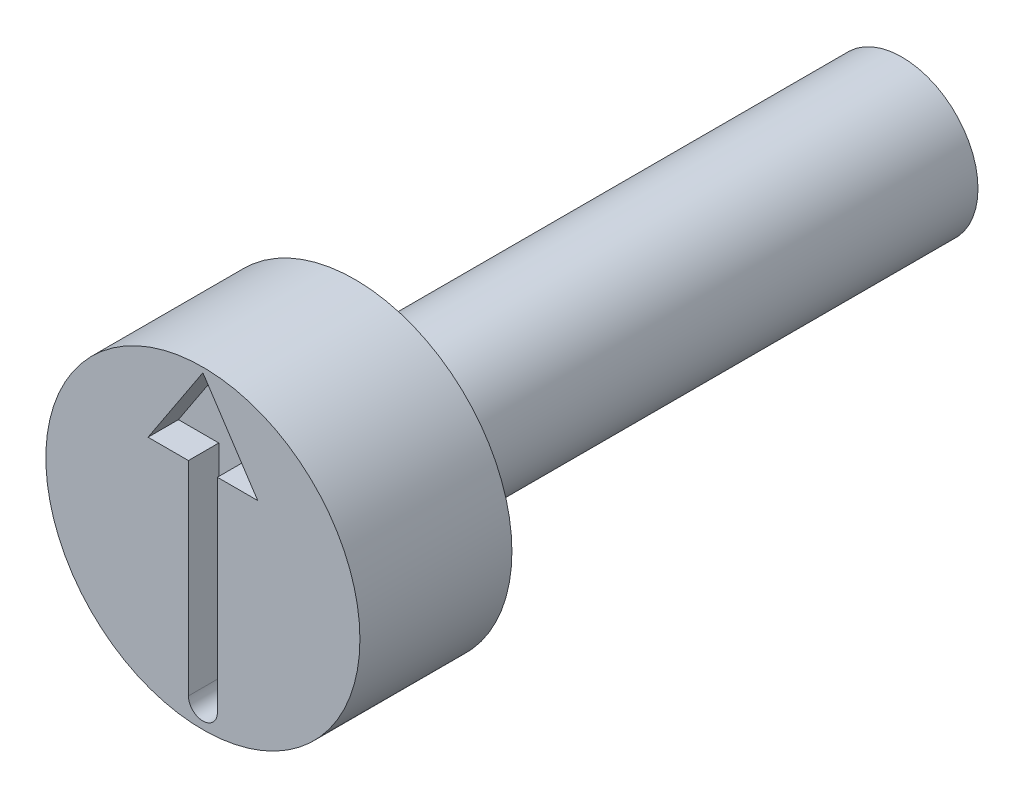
SolidWorks part; units mm, degrees
ref_plane "Front Plane" through (0, 0, 0) normal (0, 0, 1) x (1, 0, 0)
ref_plane "Top Plane" through (0, 0, 0) normal (0, 1, 0) x (1, 0, 0)
ref_plane "Right Plane" through (0, 0, 0) normal (1, 0, 0) x (0, 0, -1)
sketch "Sketch2" plane through (0, 0, 0) normal (1, 0, 0) x (0, 0, -1)
  line L0 (0.4039, 0) -> (50000.4039, 0) construction
  line L6 (0, 3.1) -> (0, 0)
  line L7 (3, 3.1) -> (0, 3.1)
  line L8 (3, 1.5) -> (3, 3.1)
  line L9 (13.8, 1.5) -> (3, 1.5)
  line L10 (13.8, 0) -> (13.8, 1.5)
  line L11 (0, 0) -> (13.8, 0)
  dimension "D1" = 6.2
  dimension "D2" = 3
  dimension "D3" = 13.8
  dimension "D4" = 3
revolve "Revolve1" add sketch "Sketch2" angle 360 about L0
sketch "Sketch3" plane through (0, 0, 0) normal (0, 0, 1) x (1, 0, 0)
  line L0 (0, 0) -> (0, 150000) construction
  line L1 (0.2857, 1.3595) -> (0.2857, -2.6642)
  line L2 (1.0829, 1.3595) -> (0.2857, 1.3595)
  line L3 (0, 3.0032) -> (1.0829, 1.3595)
  line L15 (0, 3.0032) -> (-1.0829, 1.3595)
  line L16 (-1.0829, 1.3595) -> (-0.2857, 1.3595)
  line L17 (-0.2857, 1.3595) -> (-0.2857, -2.6642)
  arc A2 (-0.2857, -2.6642) -> (0.2857, -2.6642) centre (0, -2.6642) ccw
extrude "Cut-Extrude4" cut sketch "Sketch3" against normal blind 0.6
